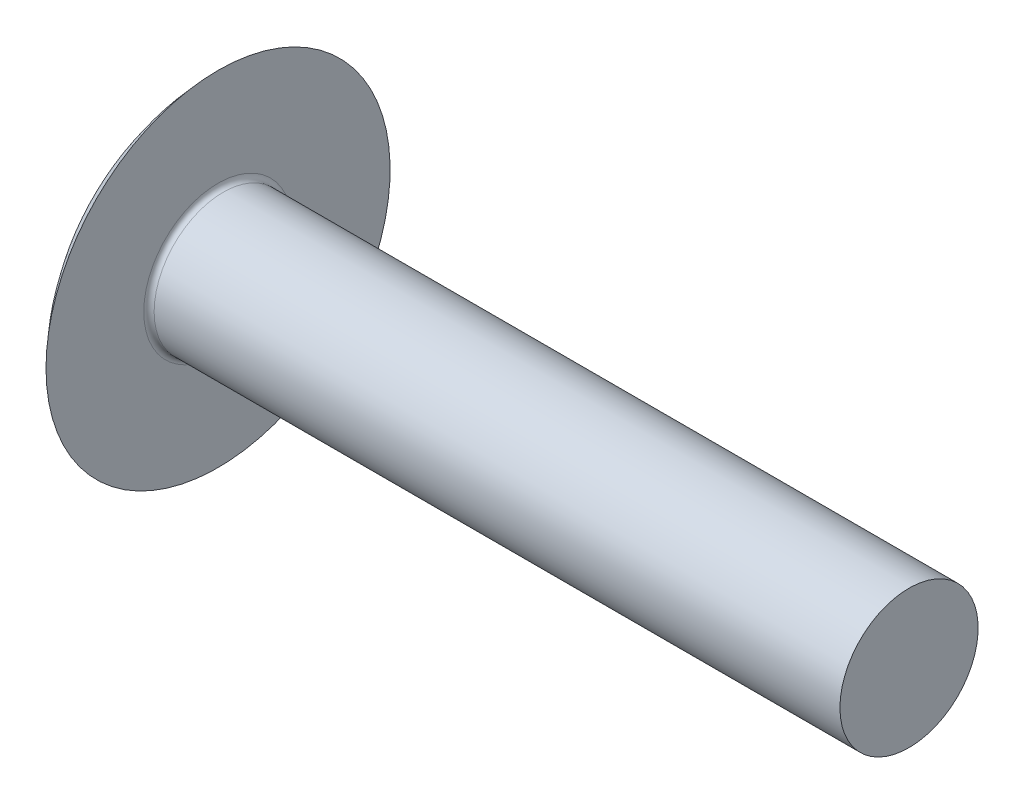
SolidWorks part; units mm, degrees
ref_plane "Front" through (0, 0, 0) normal (0, 0, 1) x (1, 0, 0)
ref_plane "Top" through (0, 0, 0) normal (0, 1, 0) x (1, 0, 0)
ref_plane "Right" through (0, 0, 0) normal (1, 0, 0) x (0, 0, -1)
other "Configuration Table"
sketch "Sketch1" plane through (0, 0, 0) normal (0, 0, 1) x (1, 0, 0)
  line L0 (-60.0944, 0) -> (17.9503, 0) construction
  line L1 (43.962, 0) -> (43.962, 4)
  line L2 (43.962, 4) -> (4.262, 4)
  line L3 (3.962, 4.3) -> (3.962, 9.96)
  line L4 (43.962, 0) -> (0, 0)
  arc A0 (3.962, 9.96) -> (0, 0) centre (14.5, 0) ccw
  arc A1 (4.262, 4) -> (3.962, 4.3) centre (4.262, 4.3) cw
  dimension "R" = 14.5
  dimension "r1" = 0.3
  dimension "d" = 8
  dimension "dk" = 19.92
  dimension "l" = 40
revolve "Base-Revolve" add sketch "Sketch1" angle 360 about L0
